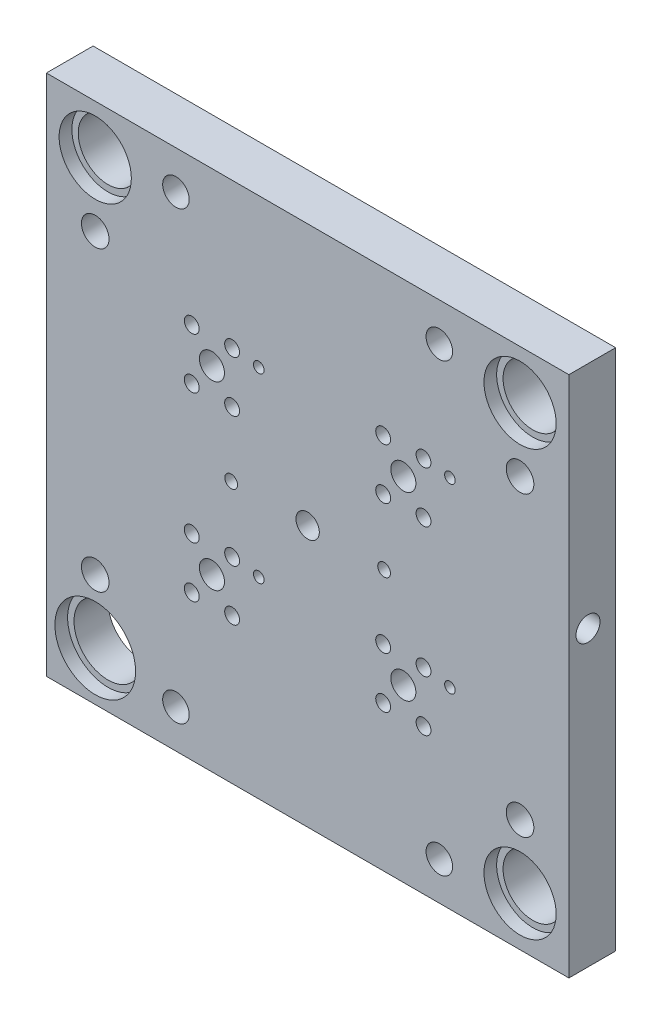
SolidWorks part; units mm, degrees
ref_plane "Plan de face" through (0, 0, 0) normal (0, 0, 1) x (1, 0, 0)
ref_plane "Plan de dessus" through (0, 0, 0) normal (0, 1, 0) x (1, 0, 0)
ref_plane "Plan de droite" through (0, 0, 0) normal (1, 0, 0) x (0, 0, -1)
sketch "Esquisse1" plane through (0, 0, 0) normal (0, 0, 1) x (1, 0, 0)
  line L1 (-123, 123) -> (123, 123)
  line L2 (-123, 123) -> (-123, -123)
  line L3 (-123, -123) -> (123, -123)
  line L4 (123, 123) -> (123, -123)
  line L5 (-123, 123) -> (123, -123) construction
  line L6 (-123, -123) -> (123, 123) construction
  point P0 (0, 0)
  dimension "D1" = 246
  dimension "D2" = 246
extrude "Extrusion1" add sketch "Esquisse1" along normal blind 22
sketch "Esquisse2" plane through (0, 0, 22) normal (0, 0, 1) x (1, 0, 0)
  line L0 (-123, 123) -> (-123, -123) construction
  line L1 (123, 123) -> (-123, 123) construction
  circle A0 centre (-100, 100) radius 14
  dimension "D1" = 28
  dimension "D2" = 23
  dimension "D3" = 23
extrude "Extrusion2" cut sketch "Esquisse2" against normal through all
pattern_linear "Répétition linéaire1" count 2 spacing 200 along (1, 0, 0) count 2 spacing 200 along (0, -1, 0) of "Extrusion2"
sketch "Esquisse4" plane through (0, 0, 22) normal (0, 0, 1) x (1, 0, 0)
  circle A0 centre (-100, 100) radius 17
  circle A1 centre (-100, 100) radius 14 construction
  dimension "D1" = 34
extrude "Extrusion4" cut sketch "Esquisse4" against normal blind 6
pattern_linear "Répétition linéaire3" count 2 spacing 200 along (1, 0, 0) count 2 spacing 200 along (0, -1, 0) of "Extrusion4"
sketch "Esquisse5" plane through (0, 0, 22) normal (0, 0, 1) x (1, 0, 0)
  line L0 (-123, 123) -> (-123, -123) construction
  line L1 (123, 123) -> (-123, 123) construction
  line L2 (-123, -123) -> (123, -123) construction
  line L3 (123, -123) -> (123, 123) construction
  circle A0 centre (-54.56, 54.56) radius 3.5
  circle A1 centre (-54.56, 30.56) radius 3.5
  circle A2 centre (-54.56, -30.56) radius 3.5
  circle A3 centre (-54.56, -54.56) radius 3.5
  circle A4 centre (54.56, 54.56) radius 3.5
  circle A5 centre (54.56, 30.56) radius 3.5
  circle A6 centre (54.56, -30.56) radius 3.5
  circle A7 centre (54.56, -54.56) radius 3.5
  dimension "D1" = 7
  dimension "D2" = 68.44
  dimension "D3" = 68.44
  dimension "D4" = 68.44
  dimension "D5" = 68.44
  dimension "D6" = 68.44
  dimension "D7" = 24
  dimension "D9" = 24
  dimension "D11" = 68.44
  dimension "D13" = 68.44
  dimension "D14" = 68.44
  dimension "D15" = 24
  dimension "D16" = 24
  dimension "D17" = 68.44
  dimension "D8" = 68.44
  dimension "D10" = 68.44
  dimension "D12" = 68.44
extrude "Extrusion5" cut sketch "Esquisse5" against normal through all
sketch "Esquisse6" plane through (0, 0, 22) normal (0, 0, 1) x (1, 0, 0)
  line L0 (123, 123) -> (-123, 123) construction
  line L1 (-123, -123) -> (123, -123) construction
  circle A0 centre (-35.56, 54.56) radius 3.5
  circle A1 centre (-35.56, 30.56) radius 3.5
  circle A2 centre (-35.56, -30.56) radius 3.5
  circle A3 centre (-35.56, -54.56) radius 3.5
  circle A4 centre (35.56, -30.56) radius 3.5
  circle A5 centre (35.56, -54.56) radius 3.5
  circle A6 centre (35.56, 30.56) radius 3.5
  circle A7 centre (35.56, 54.56) radius 3.5
  circle A8 centre (-54.56, 54.56) radius 3.5 construction
  circle A10 centre (-54.56, 30.56) radius 3.5 construction
  circle A11 centre (54.56, 30.56) radius 3.5 construction
  circle A12 centre (54.56, 54.56) radius 3.5 construction
  circle A13 centre (54.56, -30.56) radius 3.5 construction
  circle A14 centre (54.56, -54.56) radius 3.5 construction
  circle A15 centre (-54.56, -54.56) radius 3.5 construction
  circle A16 centre (-54.56, -30.56) radius 3.5 construction
  dimension "D1" = 7
  dimension "D3" = 68.44
  dimension "D4" = 7
  dimension "D6" = 19
  dimension "D7" = 24
  dimension "D9" = 19
  dimension "D10" = 24
  dimension "D12" = 19
  dimension "D13" = 24
  dimension "D15" = 24
  dimension "D16" = 19
  dimension "D17" = 19
  dimension "D18" = 68.44
  dimension "D2" = 68.44
  dimension "D5" = 19
  dimension "D8" = 19
  dimension "D11" = 19
  dimension "D14" = 68.44
extrude "Extrusion6" cut sketch "Esquisse6" against normal through all
sketch "Esquisse13" plane through (0, 0, 0) normal (0, 0, -1) x (-1, 0, 0)
  circle A0 centre (0, 0) radius 5.5
  dimension "D1" = 11
extrude "Extrusion8" cut sketch "Esquisse13" against normal through all
sketch "Esquisse14" plane through (0, 0, 22) normal (0, 0, 1) x (1, 0, 0)
  circle A0 centre (-36, 0) radius 3
  circle A1 centre (36, 0) radius 3
  circle A2 centre (0, 0) radius 5.5 construction
  dimension "D1" = 36
  dimension "D2" = 36
  dimension "D3" = 6
  dimension "D4" = 6
extrude "Extrusion9" cut sketch "Esquisse14" against normal through all
sketch "Esquisse15" plane through (0, 0, 22) normal (0, 0, 1) x (1, 0, 0)
  line L0 (-123, 123) -> (-123, -123) construction
  circle A0 centre (-100, 70) radius 6.5
  circle A1 centre (-100, 100) radius 14 construction
  dimension "D1" = 23
  dimension "D2" = 30
  dimension "D3" = 13
extrude "Extrusion10" cut sketch "Esquisse15" against normal through all
pattern_linear "Répétition linéaire9" count 2 spacing 200 along (1, 0, 0) count 2 spacing 140 along (0, -1, 0) of "Extrusion10"
sketch "Esquisse16" plane through (0, 0, 0) normal (0, 0, -1) x (-1, 0, 0)
  line L0 (-123, 123) -> (123, 123) construction
  line L1 (-123, -123) -> (-123, 123) construction
  circle A0 centre (-62, 105) radius 6.25
  dimension "D2" = 12.5
  dimension "D3" = 61
  dimension "D1" = 18
extrude "Extrusion11" cut sketch "Esquisse16" against normal through all
pattern_linear "Répétition linéaire10" count 2 spacing 124 along (-1, 0, 0) count 2 spacing 210 along (0, -1, 0) of "Extrusion11"
sketch "Esquisse22" plane through (0, 0, 0) normal (0, 0, -1) x (-1, 0, 0)
  circle A0 centre (-45.06, 42.56) radius 5.9
  circle A1 centre (-54.56, 54.56) radius 3.5 construction
  circle A2 centre (-35.56, 54.56) radius 3.5 construction
  circle A3 centre (45.06, 42.56) radius 5.9
  circle A5 centre (54.56, 54.56) radius 3.5 construction
  circle A6 centre (45.06, -42.56) radius 5.9
  circle A7 centre (54.56, -30.56) radius 3.5 construction
  circle A8 centre (35.56, -30.56) radius 3.5 construction
  circle A9 centre (-45.06, -42.56) radius 5.9
  circle A10 centre (-54.56, -54.56) radius 3.5 construction
  circle A11 centre (-54.56, -30.56) radius 3.5 construction
  dimension "D1" = 9.5
  dimension "D2" = 12
  dimension "D3" = 11.8
  dimension "D4" = 11.8
  dimension "D5" = 12
  dimension "D6" = 9.5
  dimension "D8" = 9.5
  dimension "D9" = 11.8
  dimension "D10" = 12
  dimension "D11" = 9.5
  dimension "D12" = 11.8
  dimension "D7" = 12
extrude "Extrusion12" cut sketch "Esquisse22" against normal through all
sketch "Esquisse24" plane through (-123, 0, 0) normal (-1, 0, 0) x (0, 0, 1)
  line L0 (22, -123) -> (0, -123) construction
  line L3 (22, 123) -> (22, -123) construction
  circle A0 centre (13, 15) radius 4
  point P2 (11, -123)
  dimension "D2" = 8
  dimension "D1" = 138
  dimension "D3" = 9
extrude "Extrusion14" cut sketch "Esquisse24" against normal through all
sketch "Esquisse25" plane through (123, 0, 0) normal (1, 0, 0) x (0, 0, -1)
  circle A0 centre (-13, 15) radius 5.65
  dimension "D1" = 11.3
extrude "Extrusion15" cut sketch "Esquisse25" against normal blind 15
sketch "Esquisse26" plane through (-123, 0, 0) normal (-1, 0, 0) x (0, 0, 1)
  circle A0 centre (13, 15) radius 5.65
  dimension "D1" = 11.3
extrude "Extrusion16" cut sketch "Esquisse26" against normal blind 15
sketch "Esquisse30" plane through (0, 0, 22) normal (0, 0, 1) x (1, 0, 0)
  circle A0 centre (-100, -100) radius 19
  dimension "D1" = 38
extrude "Extrusion20" cut sketch "Esquisse30" against normal blind 6
sketch "Esquisse31" plane through (0, 0, 22) normal (0, 0, 1) x (1, 0, 0)
  circle A0 centre (-100, -100) radius 16
  dimension "D1" = 32
extrude "Extrusion21" cut sketch "Esquisse31" against normal through all
sketch "Esquisse33" plane through (0, 0, 0) normal (0, 0, -1) x (-1, 0, 0)
  line L0 (123, 123) -> (123, -123) construction
  line L1 (-74.5, 35) -> (-59.5, 35)
  line L2 (-74.5, 35) -> (-74.5, 77)
  line L3 (-74.5, 77) -> (-59.5, 77)
  line L4 (-59.5, 35) -> (-59.5, 77)
  line L5 (123, -123) -> (-123, -123) construction
  dimension "D1" = 42
  dimension "D2" = 15
  dimension "D3" = 197.5
  dimension "D4" = 200
extrude "Extrusion23" cut sketch "Esquisse33" against normal blind 7
fillet "Congé1" radius 3 4 edges at (74.5, 35, 3.5) (59.5, 35, 3.5) (59.5, 77, 3.5) (74.5, 77, 3.5)
hole_wizard "Trou taraudé M4x0.71" positions "Esquisse35" profile "Esquisse34" tap size "M4x0.7" standard "Ansi Métrique"
sketch "Esquisse35" plane through (0, 0, 7) normal (0, 0, -1) x (-1, 0, 0)
  line L0 (-74.5, 74) -> (-74.5, 38) construction
  line L1 (-62.5, 77) -> (-71.5, 77) construction
  point P0 (-67, 70.5)
  dimension "D1" = 7.5
  dimension "D2" = 6.5
sketch "Esquisse34" plane through (67, 70.5, 7) normal (1, 0, 0) x (0, 1, 0)
  line L0 (0, 0) -> (0, 12.4914)
  line L1 (0, 12.4914) -> (1.65, 11.5)
  line L2 (1.65, 11.5) -> (1.65, 0)
  line L5 (1.65, 0) -> (0, 0)
  line L10 (0, 12.4914) -> (-1.65, 11.5) construction
  line L11 (0, -6.35) -> (0, 107.95) construction
  dimension "Diamètre du trou pour taraudage" = 3.3
  dimension "Profondeur du trou pour taraudage" = 11.5
  dimension "Angle de pointe" = 118
pattern_linear "Répétition linéaire11" count 2 spacing 29 along (0, -1, 0) of "Trou taraudé M4x0.71"
pattern_linear "Répétition linéaire12" count 2 spacing 85.5 along (0, -1, 0) count 2 spacing 90 along (-1, 0, 0) of "Extrusion23", "Congé1", "Trou taraudé M4x0.71", "Répétition linéaire11"
sketch "Esquisse36" plane through (0, 0, 7) normal (0, 0, -1) x (-1, 0, 0)
  line L0 (-74.5, 74) -> (-74.5, 38) construction
  line L2 (-71.5, 35) -> (-62.5, 35) construction
  circle A0 centre (-67, 53) radius 2.5
  dimension "D2" = 5
  dimension "D1" = 7.5
  dimension "D3" = 18
extrude "Extrusion24" cut sketch "Esquisse36" against normal through all
pattern_linear "Répétition linéaire13" count 2 spacing 85.5 along (0, -1, 0) count 2 spacing 90 along (-1, 0, 0) of "Extrusion24"
